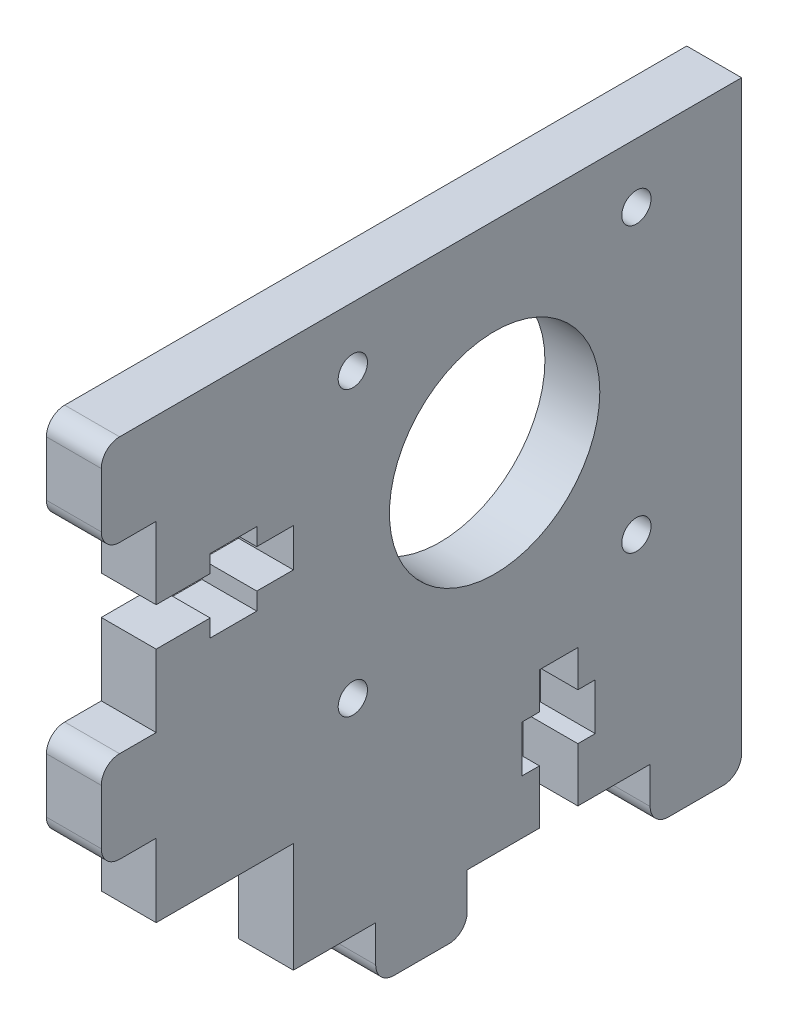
SolidWorks part; units mm, degrees
ref_plane "Спереди" through (0, 0, 0) normal (0, 0, 1) x (1, 0, 0)
ref_plane "Сверху" through (0, 0, 0) normal (0, 1, 0) x (1, 0, 0)
ref_plane "Справа" through (0, 0, 0) normal (1, 0, 0) x (0, 0, -1)
sketch "Эскиз1" plane through (0, 0, 0) normal (1, 0, 0) x (0, 0, -1)
  line L1 (0, 0) -> (64, 0)
  line L2 (0, 0) -> (0, 60)
  line L3 (0, 60) -> (64, 60)
  line L4 (64, 0) -> (64, 60)
  line L5 (0, 60) -> (-4, 60)
  line L6 (0, 60) -> (0, 50)
  line L7 (0, 50) -> (-4, 50)
  line L8 (-6, 58) -> (-6, 52)
  line L9 (0, 30) -> (-4, 30)
  line L10 (0, 30) -> (0, 20)
  line L11 (0, 20) -> (-4, 20)
  line L12 (-6, 28) -> (-6, 22)
  line L13 (0, 42.1) -> (15, 42.1)
  line L14 (0, 42.1) -> (0, 37.9)
  line L15 (0, 37.9) -> (15, 37.9)
  line L16 (15, 42.1) -> (15, 37.9)
  line L17 (5.9, 44) -> (11, 44)
  line L18 (5.9, 44) -> (5.9, 36)
  line L19 (5.9, 36) -> (11, 36)
  line L20 (11, 44) -> (11, 36)
  line L21 (15, 60) -> (59, 60) construction
  line L22 (15, 60) -> (15, 16) construction
  line L23 (15, 16) -> (59, 16) construction
  line L24 (59, 60) -> (59, 16) construction
  line L25 (21.5, 53.5) -> (52.5, 53.5) construction
  line L26 (21.5, 53.5) -> (21.5, 22.5) construction
  line L27 (21.5, 22.5) -> (52.5, 22.5) construction
  line L28 (52.5, 53.5) -> (52.5, 22.5) construction
  line L29 (64, 0) -> (54, 0)
  line L30 (64, 0) -> (64, -4)
  line L31 (62, -6) -> (56, -6)
  line L32 (54, 0) -> (54, -4)
  line L33 (24, 0) -> (34, 0)
  line L34 (24, 0) -> (24, -4)
  line L35 (26, -6) -> (32, -6)
  line L36 (34, 0) -> (34, -4)
  line L37 (41.9, 0) -> (46.1, 0)
  line L38 (41.9, 0) -> (41.9, 15)
  line L39 (41.9, 15) -> (46.1, 15)
  line L40 (46.1, 0) -> (46.1, 15)
  line L41 (40, 11) -> (48, 11)
  line L42 (40, 11) -> (40, 5.9)
  line L43 (40, 5.9) -> (48, 5.9)
  line L44 (48, 11) -> (48, 5.9)
  circle A0 centre (37, 38) radius 11.5
  circle A1 centre (21.5, 53.5) radius 1.6
  circle A2 centre (52.5, 53.5) radius 1.6
  circle A3 centre (52.5, 22.5) radius 1.6
  circle A4 centre (21.5, 22.5) radius 1.6
  arc A5 (-4, 20) -> (-6, 22) centre (-4, 22) cw
  arc A6 (-4, 30) -> (-6, 28) centre (-4, 28) ccw
  arc A7 (-4, 50) -> (-6, 52) centre (-4, 52) cw
  arc A8 (-4, 60) -> (-6, 58) centre (-4, 58) ccw
  arc A9 (64, -4) -> (62, -6) centre (62, -4) cw
  arc A10 (56, -6) -> (54, -4) centre (56, -4) cw
  arc A11 (32, -6) -> (34, -4) centre (32, -4) ccw
  arc A12 (24, -4) -> (26, -6) centre (26, -4) ccw
  point P20 (15, 40)
  point P21 (11, 40)
  point P30 (59, 38)
  point P31 (52.5, 38)
  point P32 (37, 60)
  point P33 (37, 53.5)
  point P42 (-6, 20)
  point P45 (-6, 30)
  point P48 (-6, 50)
  point P51 (-6, 60)
  point P67 (44, 15)
  point P68 (44, 11)
  point P71 (64, -6)
  point P74 (54, -6)
  point P77 (34, -6)
  point P80 (24, -6)
extrude "Бобышка-Вытянуть1" add sketch "Эскиз1" along normal blind 6 contours L5 A8 L8 A7 L7 L2 | L9 A6 L12 A5 L11 L2 | L34 A12 L35 A11 L36 L1 | A10 L31 A9 L30 L1 L32 | L41 L44 L43 L40 L1 L4 L3 L2 L13 L18 L17 L20 L16 L15 L19 L38 L42 L39 A4 A3 A2 A1 A0
sketch "Эскиз2" plane through (6, 0, 0) normal (1, 0, 0) x (0, 0, -1)
  line L0 (0, 0) -> (0, 20) construction
  line L1 (0, 12) -> (15, 12)
  line L2 (0, 12) -> (0, 0)
  line L3 (0, 0) -> (15, 0)
  line L4 (15, 12) -> (15, 0)
  dimension "D1" = 12
  dimension "D2" = 15
extrude "Вырез-Вытянуть1" cut sketch "Эскиз2" against normal through all
equation "\"D11@Эскиз1\"=\"D5@Эскиз1\"/2"
equation "\"D33@Эскиз1\"=\"D27@Эскиз1\"/2"
